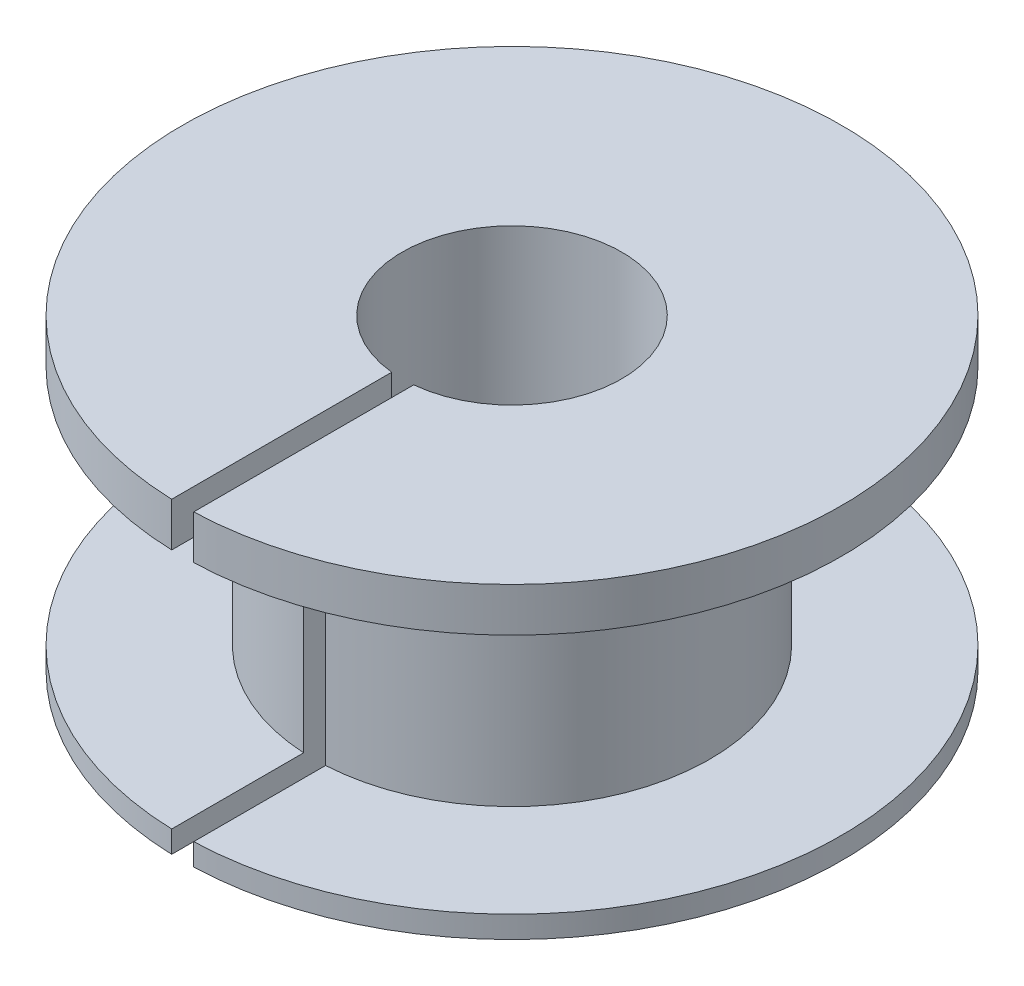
SolidWorks part; units mm, degrees
ref_plane "Plan de face" through (0, 0, 0) normal (0, 0, 1) x (1, 0, 0)
ref_plane "Plan de dessus" through (0, 0, 0) normal (0, 1, 0) x (1, 0, 0)
ref_plane "Plan de droite" through (0, 0, 0) normal (1, 0, 0) x (0, 0, -1)
sketch "Esquisse1" plane through (0, 0, 0) normal (0, 0, 1) x (1, 0, 0)
  line L0 (-75, 60) -> (-75, 70)
  line L1 (-25, 0) -> (-75, 0)
  line L2 (0, 0) -> (0, 70) construction
  line L3 (-25, 70) -> (-75, 70)
  line L4 (-75, 0) -> (-75, 5)
  line L5 (-75, 60) -> (-45, 60)
  line L6 (-25, 70) -> (-25, 0)
  line L7 (-75, 5) -> (-45, 5)
  line L8 (-45, 60) -> (-45, 5)
  line L9 (-25, 70) -> (0, 70) construction
  line L10 (-25, 0) -> (0, 0) construction
  dimension "D1" = 55
  dimension "D2" = 75
  dimension "D3" = 45
  dimension "D4" = 10
  dimension "D5" = 5
  dimension "D6" = 25
revolve "Révolution1" add sketch "Esquisse1" angle 360 about L2
sketch "Esquisse2" plane through (0, 0, 0) normal (0, 1, 0) x (1, 0, 0)
  line L1 (-2.5, -11.7845) -> (2.5, -11.7845)
  line L2 (-2.5, -11.7845) -> (-2.5, -91.7845)
  line L3 (-2.5, -91.7845) -> (2.5, -91.7845)
  line L4 (2.5, -11.7845) -> (2.5, -91.7845)
  dimension "D1" = 5
  dimension "D2" = 2.5
  dimension "D3" = 80
extrude "Enlèv. mat.-Extru.2" cut sketch "Esquisse2" along normal through all
